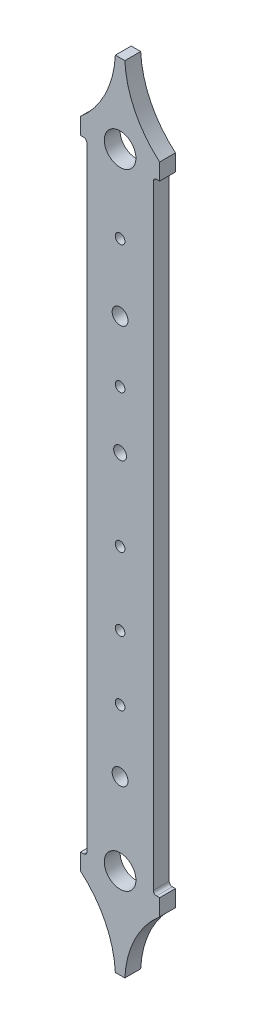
SolidWorks part; units mm, degrees
ref_plane "Front Plane" through (0, 0, 0) normal (0, 0, 1) x (1, 0, 0)
ref_plane "Top Plane" through (0, 0, 0) normal (0, 1, 0) x (1, 0, 0)
ref_plane "Right Plane" through (0, 0, 0) normal (1, 0, 0) x (0, 0, -1)
sketch "Sketch1" plane through (0, 0, 0) normal (0, 0, 1) x (1, 0, 0)
  line L0 (25, -196.0637) -> (21, -196.0637)
  line L1 (-21, 196.0637) -> (-25, 196.0637)
  line L2 (25, 196.0637) -> (25, 206.5337)
  line L3 (3, 251) -> (-3, 251)
  line L4 (-25, 196.0637) -> (-25, 206.5337)
  line L5 (-25, -196.0637) -> (-25, -206.5337)
  line L6 (3, -251) -> (-3, -251)
  line L7 (25, 196.0637) -> (21, 196.0637)
  line L8 (25, -196.0637) -> (25, -206.5337)
  line L9 (-21, -196.0637) -> (-25, -196.0637)
  line L15 (-21, -196.0637) -> (-21, 196.0637)
  line L18 (21, -196.0637) -> (21, 196.0637)
  arc A0 (3, 251) -> (25, 206.5337) centre (65.4177, 254.2061) ccw
  arc A1 (-3, 251) -> (-25, 206.5337) centre (-65.4177, 254.2061) cw
  arc A2 (-3, -251) -> (-25, -206.5337) centre (-65.4177, -254.2061) ccw
  arc A3 (3, -251) -> (25, -206.5337) centre (65.4177, -254.2061) cw
  point P0 (0, 0)
  point P4 (21, 0)
  point P11 (0, 251)
  point P16 (-21, 0)
  point P27 (0, -251)
  dimension "D5" = 62.5
  dimension "D3" = 6
extrude "Boss-Extrude1" add sketch "Sketch1" along normal blind 10
fillet "Fillet1" radius 2 4 edges at (21, -196.0637, 5) (-21, -196.0637, 5) (-21, 196.0637, 5) (21, 196.0637, 5)
sketch "Sketch3" plane through (0, 0, 10) normal (0, 0, 1) x (1, 0, 0)
  line L0 (23, 196.0637) -> (25, 196.0637) construction
  circle A0 centre (0, 201.0637) radius 10
  circle A1 centre (0, 152.0637) radius 3.05
  circle A2 centre (0, 109.6637) radius 5
  circle A3 centre (0, 71.0637) radius 3.05
  circle A4 centre (0, 34.9137) radius 4.05
  circle A5 centre (0, -16.3363) radius 3.05
  circle A6 centre (0, -62.3363) radius 3.05
  circle A7 centre (0, -103.0163) radius 3.05
  circle A8 centre (0, -142.3363) radius 5
  circle A9 centre (0, -193.9363) radius 10
  dimension "D1" = 20
  dimension "D2" = 6.1
  dimension "D3" = 10
  dimension "D4" = 6.1
  dimension "D5" = 8.1
  dimension "D6" = 6.1
  dimension "D7" = 6.1
  dimension "D8" = 6.1
  dimension "D9" = 10
  dimension "D10" = 20
  dimension "D12" = 5
  dimension "D13" = 49
  dimension "D14" = 42.4
  dimension "D15" = 38.6
  dimension "D16" = 36.15
  dimension "D17" = 51.25
  dimension "D18" = 46
  dimension "D19" = 40.68
  dimension "D20" = 39.32
  dimension "D21" = 51.6
extrude "Cut-Extrude1" cut sketch "Sketch3" against normal blind 56
